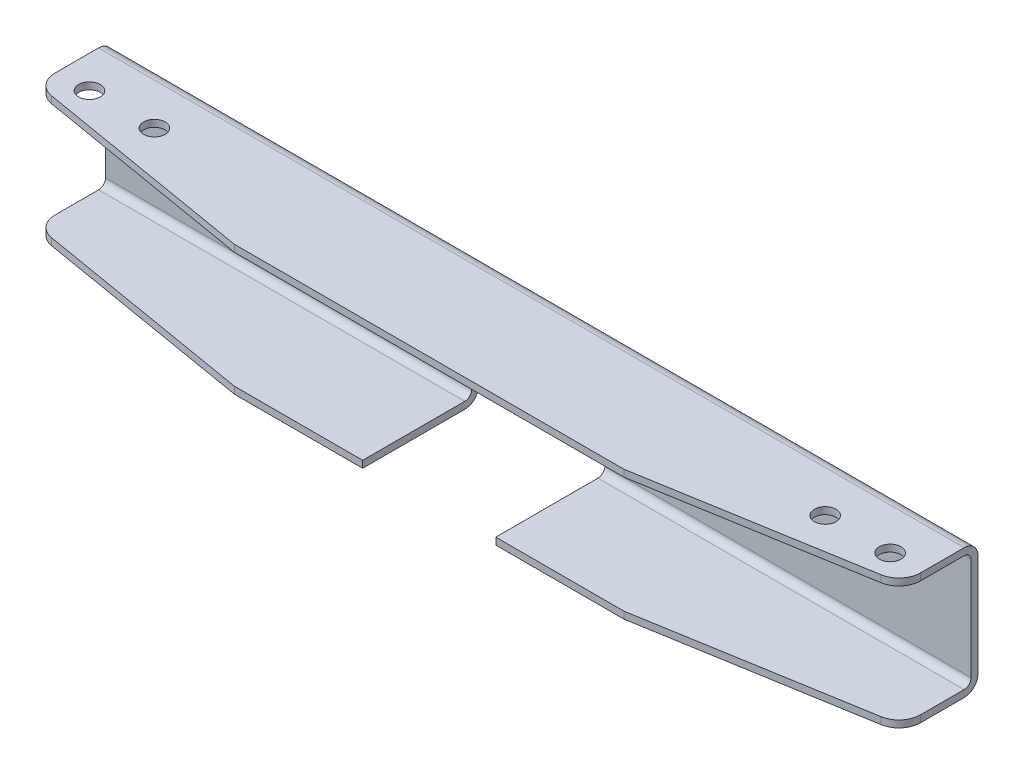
SolidWorks part; units mm, degrees
ref_plane "Plan de face" through (0, 0, 0) normal (0, 0, 1) x (1, 0, 0)
ref_plane "Plan de dessus" through (0, 0, 0) normal (0, 1, 0) x (1, 0, 0)
ref_plane "Plan de droite" through (0, 0, 0) normal (1, 0, 0) x (0, 0, -1)
sketch "Esquisse1" plane through (0, 0, 0) normal (0, 0, 1) x (1, 0, 0)
  line L0 (0, 0) -> (400, 0)
  dimension "D1" = 400
other "Elément mécano-soudé1"
ref_plane "Plan2" through (0, 0, 0) normal (1, 0, 0) x (0, 1, 0)
sketch "Sketch16" plane through (0, 0, 0) normal (1, 0, 0) x (0, 1, 0)
  line L0 (-23.6, -26.8) -> (23.6, -26.8)
  line L1 (-26.8, -23.6) -> (-26.8, 23.6)
  line L2 (23.6, 26.8) -> (-23.6, 26.8)
  line L3 (26.8, 23.6) -> (26.8, -23.6)
  line L4 (-23.6, -30) -> (23.6, -30)
  line L5 (-30, -23.6) -> (-30, 23.6)
  line L6 (23.6, 30) -> (-23.6, 30)
  line L7 (30, 23.6) -> (30, -23.6)
  line L8 (-30, 0) -> (-26.8, 0) construction
  line L9 (-26.8, 0) -> (26.8, 0) construction
  line L10 (26.8, 0) -> (30, 0) construction
  line L12 (0, 30) -> (0, 26.8) construction
  line L13 (0, 26.8) -> (0, -26.8) construction
  line L14 (0, -26.8) -> (0, -30) construction
  arc A0 (30, 23.6) -> (23.6, 30) centre (23.6, 23.6) ccw
  arc A1 (23.6, -30) -> (30, -23.6) centre (23.6, -23.6) ccw
  arc A2 (-30, -23.6) -> (-23.6, -30) centre (-23.6, -23.6) ccw
  arc A3 (-23.6, 30) -> (-30, 23.6) centre (-23.6, 23.6) ccw
  arc A4 (-23.6, 26.8) -> (-26.8, 23.6) centre (-23.6, 23.6) ccw
  arc A5 (26.8, 23.6) -> (23.6, 26.8) centre (23.6, 23.6) ccw
  arc A6 (23.6, -26.8) -> (26.8, -23.6) centre (23.6, -23.6) ccw
  arc A7 (-26.8, -23.6) -> (-23.6, -26.8) centre (-23.6, -23.6) ccw
  point P2 (-30, 30)
  point P33 (-30, -30)
  point P34 (30, -30)
  point P36 (30, 30)
  point P37 (0, 0)
  dimension "D1" = 6.4
  dimension "Thickness" = 3.2
  dimension "V_leg" = 60
  dimension "H_leg" = 60
sketch "Esquisse10" plane through (0, 0, 30) normal (0, 0, 1) x (1, 0, 0)
  line L1 (0, 30) -> (400, 30)
  line L2 (0, 30) -> (0, -30)
  line L3 (0, -30) -> (400, -30)
  line L4 (400, 30) -> (400, -30)
extrude "Extrusion3" cut sketch "Esquisse10" against normal up to vertex (6.4 mm away)
sketch "Esquisse11" plane through (0, 30, 0) normal (0, 1, 0) x (1, 0, 0)
  line L0 (0, -5) -> (110, -23.6)
  line L1 (0, 23.6) -> (0, -23.6) construction
  line L2 (400, -23.6) -> (0, -23.6) construction
  line L3 (290, -23.6) -> (400, -5)
  line L4 (400, 23.6) -> (400, -23.6) construction
  line L5 (400, 30) -> (0, 30) construction
  line L6 (0, -5) -> (0, -23.6)
  line L7 (0, -23.6) -> (110, -23.6)
  line L8 (290, -23.6) -> (400, -23.6)
  line L9 (400, -23.6) -> (400, -5)
  dimension "D1" = 35
  dimension "D2" = 35
  dimension "D3" = 180
extrude "Extrusion4" cut sketch "Esquisse11" against normal up to next
ref_plane "Plan de symétrie" through (0, 0, 0) normal (0, -1, 0) x (1, 0, 0)
mirror "Symétrie1" about plane through (0, 0, 0) normal (0, -1, 0) of "Extrusion4"
sketch "Esquisse12" plane through (0, 0, -26.8) normal (0, 0, 1) x (1, 0, 0)
  line L0 (400, 26.8) -> (0, 26.8) construction
  line L1 (169.25, 26.8) -> (230.75, 26.8)
  line L2 (169.25, 26.8) -> (169.25, -30)
  line L3 (169.25, -30) -> (230.75, -30)
  line L4 (230.75, 26.8) -> (230.75, -30)
  line L5 (290, -30) -> (110, -30) construction
  line L6 (290, 26.8) -> (110, 26.8) construction
  point P8 (200, 26.8)
  point P9 (200, 26.8)
  dimension "D1" = 61.5
extrude "Extrusion5" cut sketch "Esquisse12" against normal up to next and the other way up to next
sketch "Esquisse13" plane through (0, 30, 0) normal (0, 1, 0) x (-1, 0, 0)
  line L0 (0, -4.4) -> (-400, -4.4) construction
  line L4 (-290, 23.6) -> (-110, 23.6) construction
  circle A0 centre (-15, -4.4) radius 5
  circle A1 centre (-45, -4.4) radius 5
  circle A2 centre (-355, -4.4) radius 5
  circle A3 centre (-385, -4.4) radius 5
  point P6 (-15, -4.4)
  point P7 (-45, -4.4)
  point P8 (-385, -4.4)
  point P9 (-355, -4.4)
  dimension "D5" = 10
  dimension "D1" = 30
  dimension "D2" = 30
  dimension "D3" = 15
  dimension "D4" = 28
ref_plane "Plan4" through (200, 0, 0) normal (1, 0, 0) x (0, 0, -1)
extrude "Extrusion6" cut sketch "Esquisse13" against normal up to next
fillet "Congé2" radius 10 4 edges at (400, -28.4, 5) (400, 28.4, 5) (0, -28.4, 5) (0, 28.4, 5)
